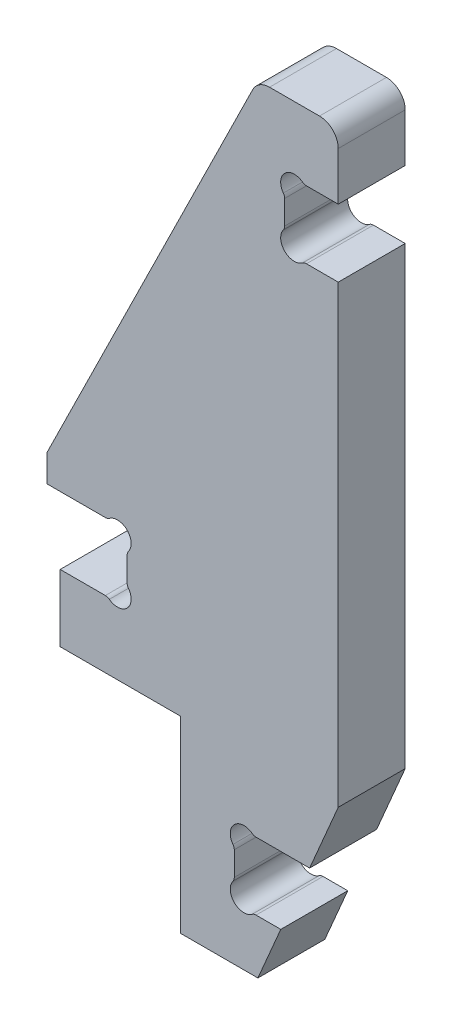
SolidWorks part; units mm, degrees
ref_plane "Plan de face" through (0, 0, 0) normal (0, 0, 1) x (1, 0, 0)
ref_plane "Plan de dessus" through (0, 0, 0) normal (0, 1, 0) x (1, 0, 0)
ref_plane "Plan de droite" through (0, 0, 0) normal (1, 0, 0) x (0, 0, -1)
sketch "Esquisse2" plane through (0, 0, 0) normal (0, 0, 1) x (1, 0, 0)
  line L0 (51.4148, 252.6) -> (38.8148, 252.6) construction
  line L2 (58.8148, 240) -> (46.9458, 240)
  line L3 (58.8148, 265.2) -> (46.9458, 265.2)
  line L4 (38.8148, 257.069) -> (38.8148, 248.131)
  line L5 (38.8148, 265.2) -> (51.4148, 252.6) construction
  line L6 (32.6, 32.6) -> (20, 32.6) construction
  line L7 (37.3618, 20) -> (28.131, 20)
  line L8 (48.131, 45.2) -> (28.131, 45.2)
  line L9 (20, 37.069) -> (20, 28.131)
  line L10 (20, 45.2) -> (32.6, 32.6) construction
  line L11 (-32.6, 107.8) -> (-20, 107.8) construction
  line L12 (-50, 120.4) -> (-28.131, 120.4)
  line L13 (-45, 95.2) -> (-28.131, 95.2)
  line L14 (-20, 103.331) -> (-20, 112.269)
  line L15 (-20, 95.2) -> (-32.6, 107.8) construction
  line L16 (-50, 120.4) -> (-50, 130.4)
  line L17 (-50, 130.4) -> (28.8148, 290.2)
  line L18 (28.8148, 290.2) -> (58.8148, 290.2)
  line L19 (58.8148, 290.2) -> (58.8148, 265.2)
  line L20 (-45, 95.2) -> (-45, 70.2)
  line L21 (-45, 70.2) -> (0, 70.2)
  line L22 (0, 70.2) -> (0, 0)
  line L23 (0, 0) -> (28.8148, 0)
  line L24 (28.8148, 0) -> (37.3618, 20)
  line L25 (48.131, 45.2) -> (58.8148, 70.2)
  line L26 (58.8148, 70.2) -> (58.8148, 240)
  arc A0 (45.4574, 265.6914) -> (38.3234, 258.5574) centre (42.421, 261.5938) ccw
  arc A1 (45.4574, 265.6914) -> (46.9458, 265.2) centre (46.9458, 267.7) ccw
  arc A2 (38.3234, 258.5574) -> (38.8148, 257.069) centre (36.3148, 257.069) cw
  arc A3 (38.3234, 246.6426) -> (38.8148, 248.131) centre (36.3148, 248.131) ccw
  arc A4 (45.4574, 239.5086) -> (38.3234, 246.6426) centre (42.421, 243.6062) cw
  arc A5 (45.4574, 239.5086) -> (46.9458, 240) centre (46.9458, 237.5) cw
  arc A6 (26.6426, 45.6914) -> (19.5086, 38.5574) centre (23.6062, 41.5938) ccw
  arc A7 (26.6426, 45.6914) -> (28.131, 45.2) centre (28.131, 47.7) ccw
  arc A8 (19.5086, 38.5574) -> (20, 37.069) centre (17.5, 37.069) cw
  arc A9 (19.5086, 26.6426) -> (20, 28.131) centre (17.5, 28.131) ccw
  arc A10 (26.6426, 19.5086) -> (19.5086, 26.6426) centre (23.6062, 23.6062) cw
  arc A11 (26.6426, 19.5086) -> (28.131, 20) centre (28.131, 17.5) cw
  arc A12 (-26.6426, 94.7086) -> (-19.5086, 101.8426) centre (-23.6062, 98.8062) ccw
  arc A13 (-26.6426, 94.7086) -> (-28.131, 95.2) centre (-28.131, 92.7) ccw
  arc A14 (-19.5086, 101.8426) -> (-20, 103.331) centre (-17.5, 103.331) cw
  arc A15 (-19.5086, 113.7574) -> (-20, 112.269) centre (-17.5, 112.269) ccw
  arc A16 (-26.6426, 120.8914) -> (-19.5086, 113.7574) centre (-23.6062, 116.7938) cw
  arc A17 (-26.6426, 120.8914) -> (-28.131, 120.4) centre (-28.131, 122.9) cw
  point P15 (38.8148, 252.6)
  point P35 (20, 32.6)
  point P59 (-20, 107.8)
extrude "Boss.-Extru.2" add sketch "Esquisse2" along normal blind 25
fillet "Congé1" radius 7 2 edges at (58.8148, 290.2, 12.5) (28.8148, 290.2, 12.5)
equation "\"D1@Boss.-Extru.2\" = \"material_thickness\""
equation "\"tool_diameter\"=10"
equation "\"hole_clearance\"=0.1"
equation "\"material_thickness\"=25"
equation "\"clearance\"=0.1"
equation "\"outer_slot\"=0.5"
equation "\"fillet\"=7"
equation "\"string\"= 2 * \"tool_diameter\" / 2 * cos ( 45deg )"
equation "\"angle\"= IIF ( \"string\" < \"limit\" , 45 , ( 180 - 2 * arcsin ( \"ThicknessVStool_dia\" ) ) / 2 )"
equation "\"limit\"= \"material_thickness\" / 2 * 5 / 6"
equation "\"ThicknessVStool_dia\"= IIF ( \"limit\" / \"tool_diameter\" > 1 , 1 , \"limit\" / \"tool_diameter\" )"
equation "\"D1@Congé1\"=\"fillet\""
equation "\"D4@Esquisse2\"=\"tool_diameter\" / 2 + \"hole_clearance\""
equation "\"D3@Esquisse2\" = \"material_thickness\" / 2 + \"clearance\""
equation "\"D5@Esquisse2\"=\"material_thickness\"/10"
equation "\"D8@Esquisse2\"=\"tool_diameter\" / 2 + \"hole_clearance\""
equation "\"D7@Esquisse2\" = \"material_thickness\" / 2 + \"clearance\""
equation "\"D9@Esquisse2\"=\"material_thickness\"/10"
equation "\"D12@Esquisse2\"=\"tool_diameter\" / 2 + \"hole_clearance\""
equation "\"D11@Esquisse2\" = \"material_thickness\" / 2 + \"clearance\""
equation "\"D17@Esquisse2\"=\"material_thickness\"/10"
equation "\"D27@Esquisse2\"=\"material_thickness\""
equation "\"D25@Esquisse2\"=\"material_thickness\""
equation "\"D10@Esquisse2\"=\"angle\""
equation "\"D21@Esquisse2\"=\"material_thickness\""
equation "\"D6@Esquisse2\"=\"angle\""
equation "\"D2@Esquisse2\"=\"angle\""
